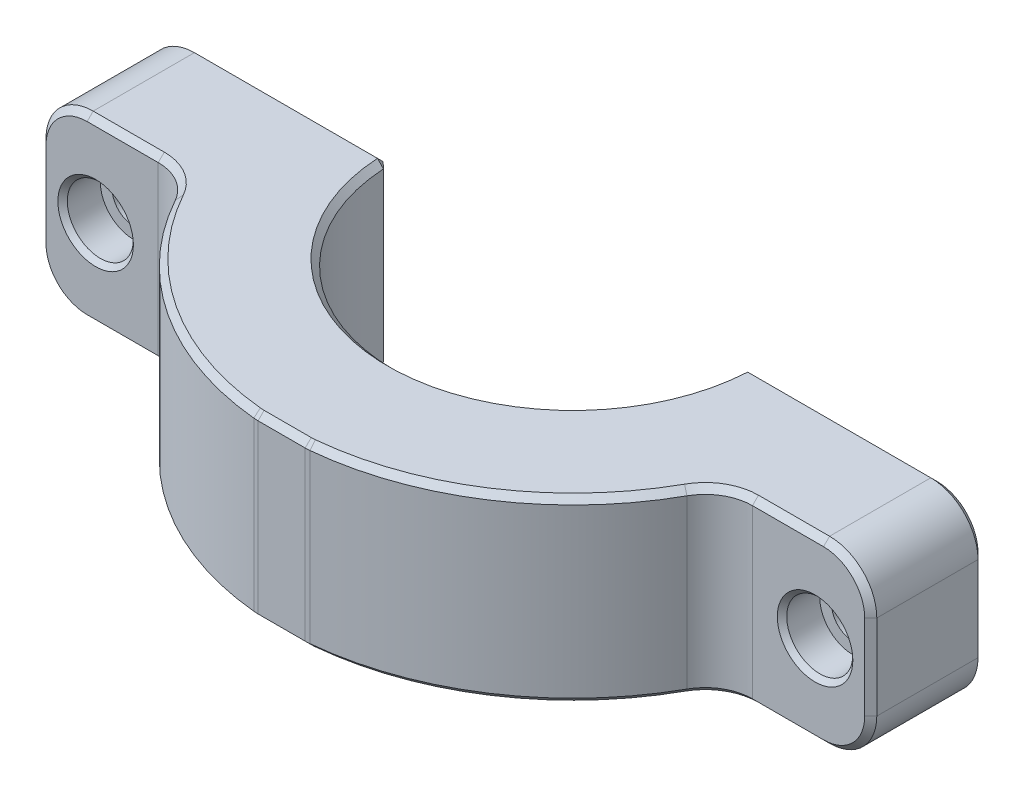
SolidWorks part; units mm, degrees
ref_plane "Front Plane" through (0, 0, 0) normal (0, 0, 1) x (1, 0, 0)
ref_plane "Top Plane" through (0, 0, 0) normal (0, 1, 0) x (1, 0, 0)
ref_plane "Right Plane" through (0, 0, 0) normal (1, 0, 0) x (0, 0, -1)
sketch "Sketch1" plane through (0, 0, 0) normal (0, 1, 0) x (1, 0, 0)
  line L1 (-69.85, 24.13) -> (69.85, 24.13)
  line L2 (-69.85, 24.13) -> (-69.85, -24.13)
  line L3 (-69.85, -24.13) -> (69.85, -24.13)
  line L4 (69.85, 24.13) -> (69.85, -24.13)
  line L5 (0, -24.13) -> (0, 24.13) construction
  line L6 (-69.85, 0) -> (69.85, 0) construction
  point P0 (0, 0)
  dimension "D1" = 139.7
  dimension "D2" = 48.26
extrude "Boss-Extrude1" add sketch "Sketch1" along normal mid plane 30.1625
sketch "Sketch2" plane through (0, 15.0812, 0) normal (0, 1, 0) x (1, 0, 0)
  line L1 (69.85, 24.13) -> (-69.85, 24.13) construction
  circle A0 centre (0, 24.892) radius 30.1625
  point P2 (0, 0)
  point P3 (0, 0)
  point P4 (0, 0)
  dimension "D1" = 60.325
  dimension "D2" = 0.762
extrude "Cut-Extrude1" cut sketch "Sketch2" against normal through all
shell "Shell9" thickness 19.05
hole_wizard "CBORE for 1/4 Socket Head Cap Screw1" positions "Sketch3" profile "Sketch4" counterbore size "1/4" standard "ANSI Inch"
sketch "Sketch3" plane through (0, 0, -5.08) normal (0, 0, 1) x (1, 0, 0)
  line L0 (-60.4874, 0) -> (60.4874, 0)
  point P3 (60.4874, 0)
  point P29 (-60.4874, 0)
  point P39 (0, 0)
  dimension "D1" = 120.9749
sketch "Sketch4" plane through (60.4874, 0, -5.08) normal (1, 0, 0) x (0, -1, 0)
  line L0 (0, 0) -> (0, 19.05)
  line L1 (0, 19.05) -> (3.5712, 19.05)
  line L3 (3.5712, 19.05) -> (3.5712, 6.35)
  line L4 (5.5562, 6.35) -> (3.5712, 6.35)
  line L5 (5.5562, 6.35) -> (5.5562, 0.7938)
  line L6 (5.5562, 0.7938) -> (6.35, 0)
  line L7 (6.35, 0) -> (0, 0)
  line L8 (-5.5562, 0.7937) -> (-6.35, 0) construction
  line L11 (0, -6.35) -> (0, 107.95) construction
  dimension "Thru Hole Dia." = 7.1425
  dimension "Thru Hole Depth" = 19.05
  dimension "C'Bore Dia." = 11.1125
  dimension "C'Bore Depth" = 6.35
  dimension "Near C'Sink Dia." = 12.7
  dimension "Near C'Sink Angle" = 90
fillet "Fillet1" radius 7.9375 8 edges at (-69.85, -15.0812, -14.605) (-69.85, 15.0812, -14.605) (69.85, -15.0812, -14.605) (69.85, 15.0812, -14.605) (4.3259, 0, 24.13) (-4.3259, 0, 24.13) (45.0484, 0, -5.08) (-45.0484, 0, -5.08)
chamfer "Chamfer1" distance 1.016 angle 45 38 edges at (-30.1529, 0, -24.13) (30.1529, 0, -24.13) (-46.0327, -15.0812, -24.13) (46.0327, -15.0812, -24.13) (-67.5252, -12.7564, -24.13) (67.5252, -12.7564, -24.13) (-69.85, 0, -24.13) (69.85, 0, -24.13) (-67.5252, 12.7564, -24.13) (67.5252, 12.7564, -24.13) (-46.0327, 15.0812, -24.13) (46.0327, 15.0812, -24.13) (0, 15.0812, 5.2705) (26.9678, -15.0812, 16.2736) (4.3423, -15.0812, 24.1208) (45.9352, -15.0812, -3.9834) (0, -15.0812, 24.13) (55.9367, -15.0812, -5.08) (-4.3423, -15.0812, 24.1208) (67.5252, -12.7564, -5.08) (-26.9678, -15.0812, 16.2736) (69.85, 0, -5.08) (-45.9352, -15.0812, -3.9834) (67.5252, 12.7564, -5.08) (-55.9367, -15.0812, -5.08) (55.9367, 15.0812, -5.08) (-67.5252, -12.7564, -5.08) (45.9352, 15.0812, -3.9834) (-69.85, 0, -5.08) (26.9678, 15.0812, 16.2736) (-67.5252, 12.7564, -5.08) (4.3423, 15.0812, 24.1208) (-55.9367, 15.0812, -5.08) (0, 15.0812, 24.13) (-45.9352, 15.0812, -3.9834) (-4.3423, 15.0812, 24.1208) (-26.9678, 15.0812, 16.2736) (0, -15.0812, 5.2705)
